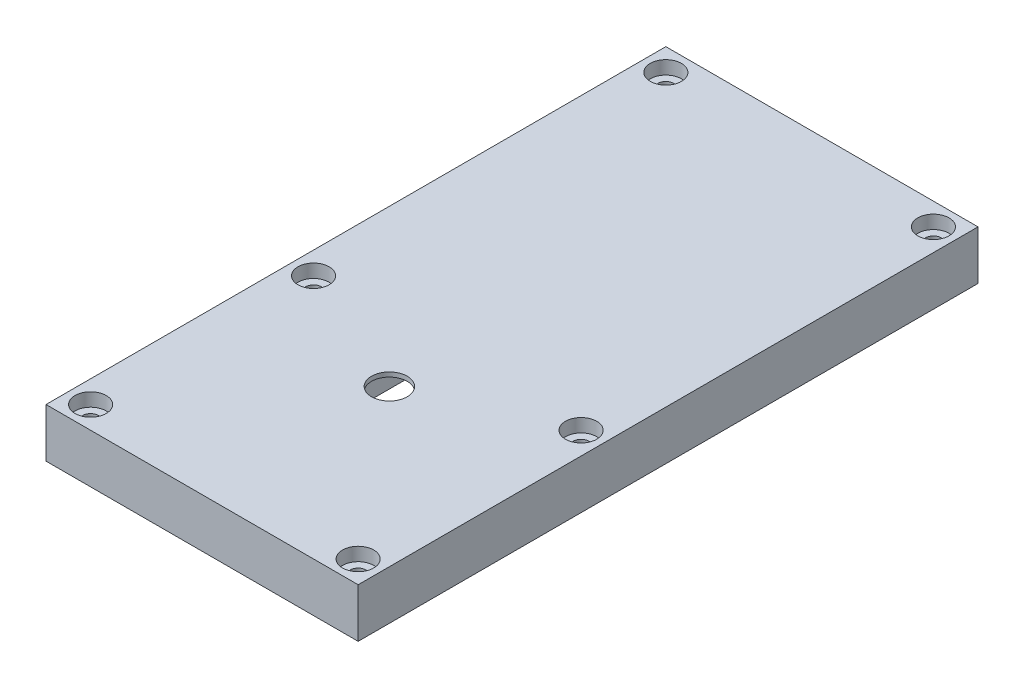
SolidWorks part; units mm, degrees
ref_plane "Спереди" through (0, 0, 0) normal (0, 0, 1) x (1, 0, 0)
ref_plane "Сверху" through (0, 0, 0) normal (0, 1, 0) x (1, 0, 0)
ref_plane "Справа" through (0, 0, 0) normal (1, 0, 0) x (0, 0, -1)
sketch "Эскиз1" plane through (0, 0, 0) normal (0, 1, 0) x (1, 0, 0)
  line L1 (-35, -69.5) -> (35, -69.5)
  line L2 (-35, -69.5) -> (-35, 69.5)
  line L3 (-35, 69.5) -> (35, 69.5)
  line L4 (35, -69.5) -> (35, 69.5)
  line L5 (-35, -69.5) -> (35, 69.5) construction
  line L6 (-35, 69.5) -> (35, -69.5) construction
  point P0 (0, 0)
  dimension "D1" = 139
  dimension "D2" = 70
extrude "Бобышка-Вытянуть1" add sketch "Эскиз1" along normal blind 11
sketch "Эскиз3" plane through (0, 11, 0) normal (0, 1, 0) x (1, 0, 0)
  circle A0 centre (0, -27.5) radius 2.5 construction
  circle A1 centre (0, 45) radius 2.5 construction
  circle A2 centre (0, -27.5) radius 2.5 construction
  circle A3 centre (0, 45) radius 2.5 construction
  circle A4 centre (0, 45) radius 3 construction
  circle A5 centre (0, -27.5) radius 4
  dimension "D1" = 6
  dimension "D2" = 8
extrude "Вырез-Вытянуть1" cut sketch "Эскиз3" against normal blind 10
sketch "Эскиз4" plane through (0, 11, 0) normal (0, 1, 0) x (1, 0, 0)
  circle A0 centre (-30, -64.5) radius 1.4 construction
  circle A1 centre (30, -64.5) radius 1.4 construction
  circle A2 centre (-30, -14.5) radius 1.4 construction
  circle A3 centre (30, -14.5) radius 1.4 construction
  circle A4 centre (-30, 64.5) radius 1.4 construction
  circle A5 centre (30, 64.5) radius 1.4 construction
  circle A6 centre (-30, -64.5) radius 1.4 construction
  circle A7 centre (30, -64.5) radius 1.4 construction
  circle A8 centre (-30, -14.5) radius 1.4 construction
  circle A9 centre (30, -14.5) radius 1.4 construction
  circle A10 centre (-30, 64.5) radius 1.4 construction
  circle A11 centre (30, 64.5) radius 1.4 construction
  circle A12 centre (-30, 64.5) radius 1.75
  circle A13 centre (30, 64.5) radius 1.75
  circle A14 centre (-30, -14.5) radius 1.75
  circle A15 centre (30, -14.5) radius 1.75
  circle A16 centre (30, -64.5) radius 1.75
  circle A17 centre (-30, -64.5) radius 1.75
  dimension "D1" = 3.5
extrude "Вырез-Вытянуть2" cut sketch "Эскиз4" against normal through all
sketch "Эскиз6" plane through (0, 0, 0) normal (0, -1, 0) x (1, 0, 0)
  line L0 (35, -69.5) -> (-35, -69.5) construction
  line L1 (-10.25, -65.5) -> (10.25, -65.5)
  line L2 (-10.25, -65.5) -> (-10.25, -69.5)
  line L3 (-10.25, -69.5) -> (10.25, -69.5)
  line L4 (10.25, -65.5) -> (10.25, -69.5)
  line L5 (0, -69.5) -> (0, -48.8275) construction
  dimension "D1" = 4
  dimension "D2" = 20.5
extrude "Бобышка-Вытянуть3" add sketch "Эскиз6" along normal blind 12.75
sketch "Эскиз7" plane through (0, 0, 0) normal (0, -1, 0) x (1, 0, 0)
  line L1 (10.5, 37.5) -> (10.5, -69.5) construction
  line L2 (-10.5, -69.5) -> (-10.5, 37.5) construction
  line L3 (-10.5, 37.5) -> (10.5, 37.5) construction
  line L4 (-10.5, -65.5) -> (10.5, -65.5)
  line L5 (10.5, 37.5) -> (10.5, -65.5)
  line L6 (-10.5, -65.5) -> (-10.5, 37.5)
  line L7 (-10.5, 37.5) -> (10.5, 37.5)
  line L8 (10.25, -65.5) -> (-10.25, -65.5) construction
extrude "Вырез-Вытянуть3" cut sketch "Эскиз7" against normal blind 10
sketch "Эскиз8" plane through (0, 11, 0) normal (0, 1, 0) x (1, 0, 0)
  circle A0 centre (-30, 64.5) radius 3.5
  circle A1 centre (30, 64.5) radius 3.5
  circle A2 centre (-30, -14.5) radius 3.5
  circle A3 centre (30, -14.5) radius 3.5
  circle A4 centre (-30, -64.5) radius 3.5
  circle A5 centre (30, -64.5) radius 3.5
  dimension "D1" = 7
extrude "Вырез-Вытянуть4" cut sketch "Эскиз8" against normal blind 3
